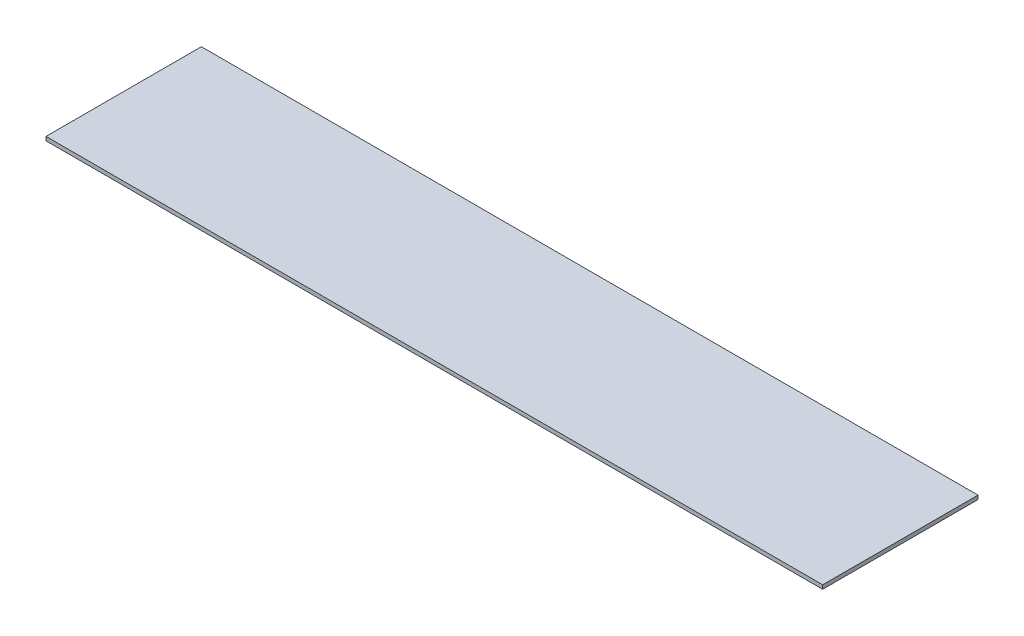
SolidWorks part; units mm, degrees
ref_plane "Front Plane" through (0, 0, 0) normal (0, 0, 1) x (1, 0, 0)
ref_plane "Top Plane" through (0, 0, 0) normal (0, 1, 0) x (1, 0, 0)
ref_plane "Right Plane" through (0, 0, 0) normal (1, 0, 0) x (0, 0, -1)
sketch "Esquisse1" plane through (0, 0, 0) normal (0, 0, 1) x (1, 0, 0)
  line L1 (0, 0) -> (2000, 0)
  line L2 (0, 0) -> (0, -10)
  line L3 (0, -10) -> (2000, -10)
  line L4 (2000, 0) -> (2000, -10)
  line L5 (0, 0) -> (2000, -10) construction
  line L6 (0, -10) -> (2000, 0) construction
  point P4 (1000, -5)
  dimension "D1" = 2000
  dimension "D2" = 10
extrude "Boss.-Extru.1" add sketch "Esquisse1" along normal mid plane 400
